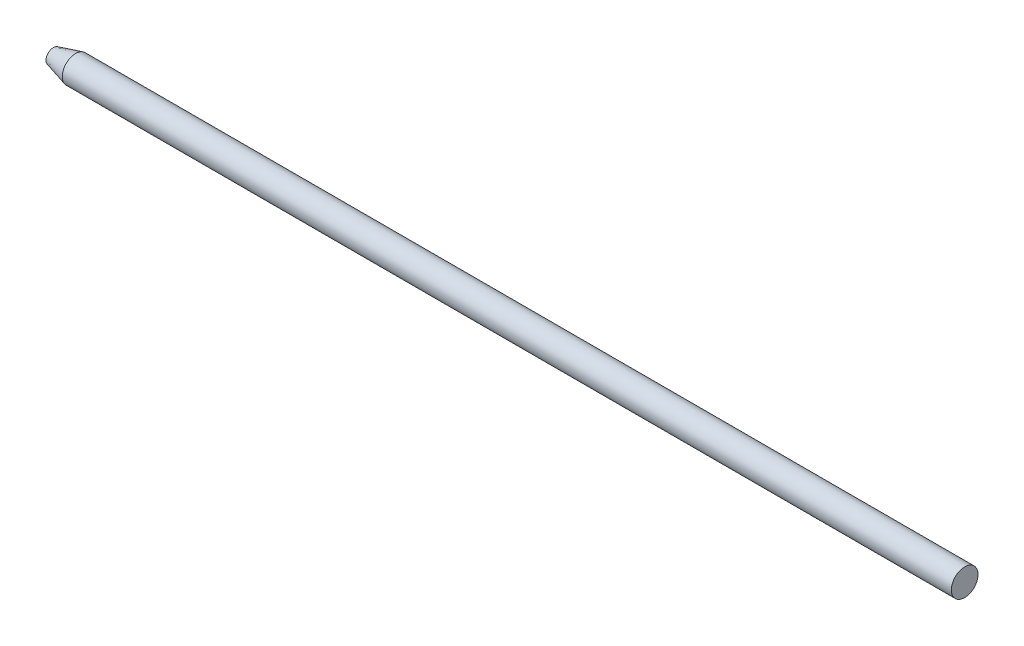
SolidWorks part; units mm, degrees
ref_plane "Vorne" through (0, 0, 0) normal (0, 0, 1) x (1, 0, 0)
ref_plane "Oben" through (0, 0, 0) normal (0, 1, 0) x (1, 0, 0)
ref_plane "Rechts" through (0, 0, 0) normal (1, 0, 0) x (0, 0, -1)
sketch "Skizze1" plane through (0, 0, 0) normal (0, 0, 1) x (1, 0, 0)
  line L0 (0, 0) -> (202.9783, 0) construction
  line L1 (0, 0) -> (0, 1.6603)
  line L2 (0, 1.6603) -> (5, 3)
  line L3 (5, 3) -> (205, 3)
  line L4 (205, 3) -> (205, 0)
  line L5 (0, 0) -> (205, 0)
  dimension "D1" = 6
  dimension "D2" = 15
  dimension "D3" = 5
  dimension "D4" = 205
revolve "Rotation1" add sketch "Skizze1" angle 360 about L0
